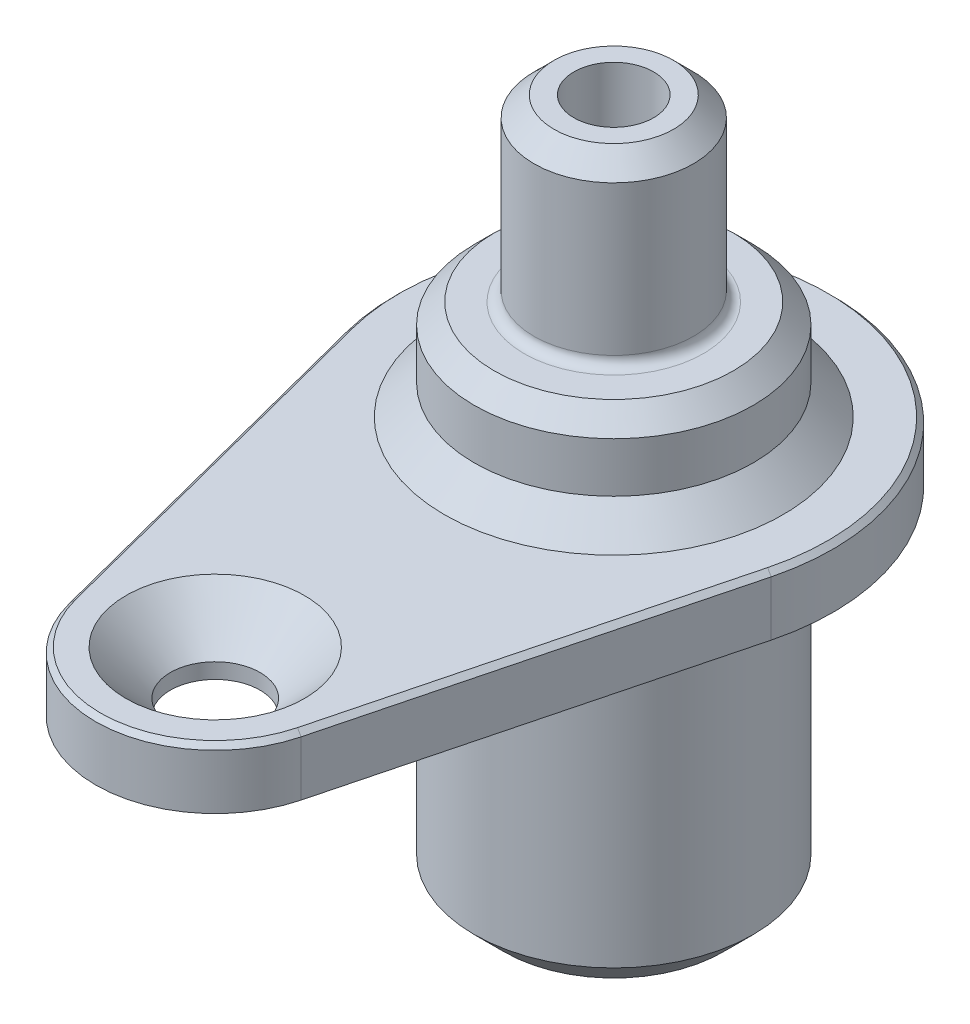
SolidWorks part; units mm, degrees
ref_plane "Front" through (0, 0, 0) normal (0, 0, 1) x (1, 0, 0)
ref_plane "Top" through (0, 0, 0) normal (0, 1, 0) x (1, 0, 0)
ref_plane "Right" through (0, 0, 0) normal (1, 0, 0) x (0, 0, -1)
sketch "Sketch1" plane through (0, 0, 0) normal (0, 1, 0) x (1, 0, 0)
  line L0 (0, 0) -> (0, -40) construction
  line L1 (21.3014, -5.5) -> (11.619, -43)
  line L2 (-11.619, -43) -> (-21.3014, -5.5)
  arc A0 (21.3014, -5.5) -> (-21.3014, -5.5) centre (0, 0) ccw
  arc A1 (-11.619, -43) -> (11.619, -43) centre (0, -40) ccw
  dimension "D2" = 22
  dimension "D3" = 12
  dimension "D1" = 40
extrude "Boss-Extrude1" add sketch "Sketch1" along normal blind 6
hole_wizard "CSK for M8 Hex Socket Countersunk Cap Screw1" positions "Sketch2" profile "Sketch3" countersink size "M8" standard "ISO"
sketch "Sketch2" plane through (0, 6, 0) normal (0, 1, 0) x (1, 0, 0)
  point P0 (0, -40)
sketch "Sketch3" plane through (0, 6, 40) normal (1, 0, 0) x (0, 0, 1)
  line L0 (0, 0) -> (0, 6)
  line L1 (0, 6) -> (4.5, 6)
  line L2 (4.5, 6) -> (4.5, 4.46)
  line L3 (4.5, 4.46) -> (8.96, 0)
  line L5 (8.96, 0) -> (0, 0)
  line L6 (-4.5, 4.46) -> (-8.96, 0) construction
  line L11 (0, -6.35) -> (0, 107.95) construction
  dimension "Thru Hole Dia." = 9
  dimension "Thru Hole Depth" = 6
  dimension "Near C'Sink Dia." = 17.92
  dimension "Near C'Sink Angle" = 90
sketch "Sketch4" plane through (0, 0, 0) normal (0, 1, 0) x (1, 0, 0)
  circle A0 centre (0, 0) radius 14
  dimension "D1" = 28
extrude "Boss-Extrude2" add sketch "Sketch4" along normal blind 34 and the other way blind 35
chamfer "Chamfer1" distance 3 angle 45 1 edges at (0, 6, 14)
chamfer "Chamfer2" distance 3 angle 45 1 edges at (0, -35, 14)
sketch "Sketch5" plane through (0, 0, 0) normal (0, 1, 0) x (1, 0, 0)
  circle A0 centre (0, 0) radius 4
  dimension "D1" = 8
extrude "Cut-Extrude1" cut sketch "Sketch5" against normal through all both and the other way through all
sketch "Sketch6" plane through (0, 34, 0) normal (0, 1, 0) x (1, 0, 0)
  circle A0 centre (0, 0) radius 8
  circle A1 centre (0, 0) radius 14
  circle A2 centre (0, 0) radius 14
  dimension "D2" = 16
  dimension "D1" = 0
extrude "Cut-Extrude2" cut sketch "Sketch6" against normal blind 18
chamfer "Chamfer3" distance 2 angle 45 1 edges at (0, 16, 14)
chamfer "Chamfer4" distance 2 angle 45 1 edges at (0, 34, 8)
fillet "Fillet1" radius 1 1 edges at (0, 16, 8)
chamfer "Chamfer5" distance 1 angle 45 1 edges at (0, 0, 14)
chamfer "Chamfer6" distance 0.5 angle 45 4 edges at (-16.4602, 6, 24.25) (0, 6, 52) (0, 6, -22) (16.4602, 6, 24.25)
